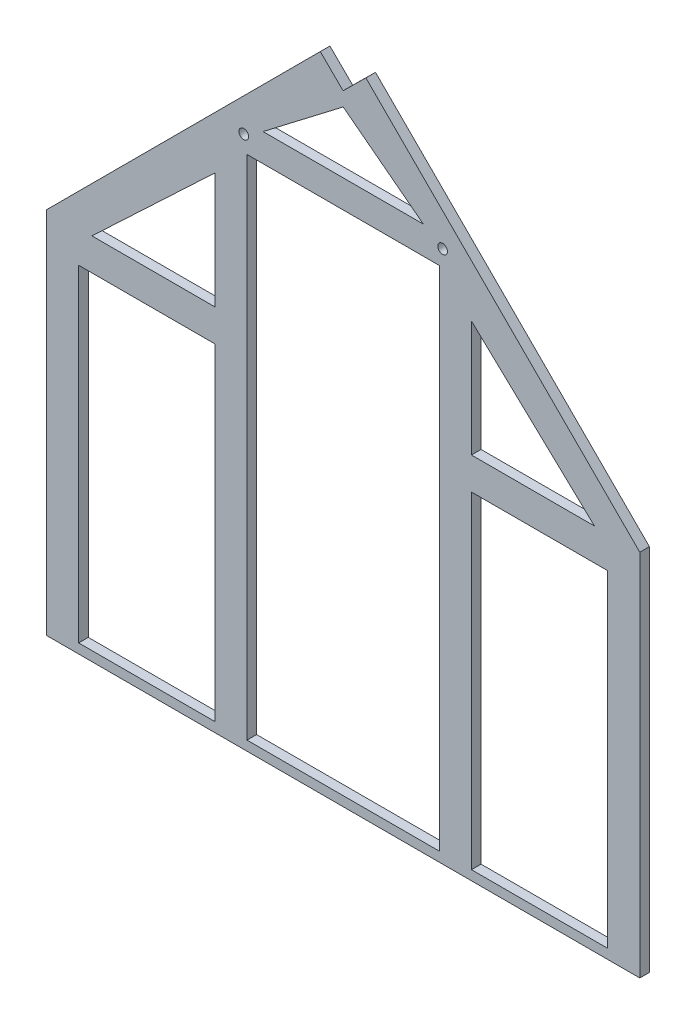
SolidWorks part; units mm, degrees
ref_plane "Plan de face" through (0, 0, 0) normal (0, 0, 1) x (1, 0, 0)
ref_plane "Plan de dessus" through (0, 0, 0) normal (0, 1, 0) x (1, 0, 0)
ref_plane "Plan de droite" through (0, 0, 0) normal (1, 0, 0) x (0, 0, -1)
sketch "Esquisse1" plane through (0, 0, 0) normal (0, 0, 1) x (1, 0, 0)
  line L0 (0, 0) -> (0, 115)
  line L1 (0, 115) -> (85.361, 200.395)
  line L2 (132.5, 151.1789) -> (132.5, 115)
  line L3 (185, 115) -> (185, 0)
  line L4 (185, 0) -> (0, 0)
  line L5 (52.5, 151.1789) -> (14.1421, 115)
  line L6 (10, 105) -> (10, 3)
  line L7 (10, 3) -> (52.5, 3)
  line L8 (52.5, 151.1789) -> (52.5, 115)
  line L9 (92.5, 209) -> (92.5, -46.3241) construction
  line L10 (170.8579, 115) -> (132.5, 115)
  line L11 (62.5, 3) -> (122.5, 3)
  line L12 (62.5, 3) -> (62.5, 161.1789)
  line L13 (62.5, 161.1789) -> (122.5, 161.1789)
  line L14 (122.5, 3) -> (122.5, 161.1789)
  line L15 (132.5, 151.1789) -> (170.8579, 115)
  line L16 (132.5, 105) -> (132.5, 3)
  line L17 (175, 3) -> (132.5, 3)
  line L18 (14.1421, 115) -> (52.5, 115)
  line L19 (10, 105) -> (52.5, 105)
  line L20 (52.5, 105) -> (52.5, 3)
  line L21 (92.5, 189) -> (67.5, 169.8579)
  line L22 (67.5, 169.8579) -> (117.5, 169.8579)
  line L23 (117.5, 169.8579) -> (92.5, 189)
  line L26 (85.361, 200.395) -> (92.4659, 193.3579)
  line L27 (99.5711, 200.395) -> (185, 115)
  line L28 (175, 105) -> (175, 3)
  line L29 (175, 105) -> (132.5, 105)
  line L30 (99.5711, 200.395) -> (92.4659, 193.3579)
  circle A0 centre (61.5, 166.1789) radius 1.5
  circle A1 centre (123.5, 166.1789) radius 1.5
  dimension "D16" = 3
  dimension "D1" = 3
  dimension "D2" = 185
  dimension "D3" = 30
  dimension "D4" = 92.5
  dimension "D5" = 10
  dimension "D6" = 30
  dimension "D7" = 10
  dimension "D8" = 10
  dimension "D9" = 3
  dimension "D10" = 10
  dimension "D11" = 115
  dimension "D12" = 25
  dimension "D13" = 50
  dimension "D14" = 10
  dimension "D15" = 20
  dimension "D17" = 5
  dimension "D18" = 31
extrude "Extrusion2" add sketch "Esquisse1" along normal blind 3
